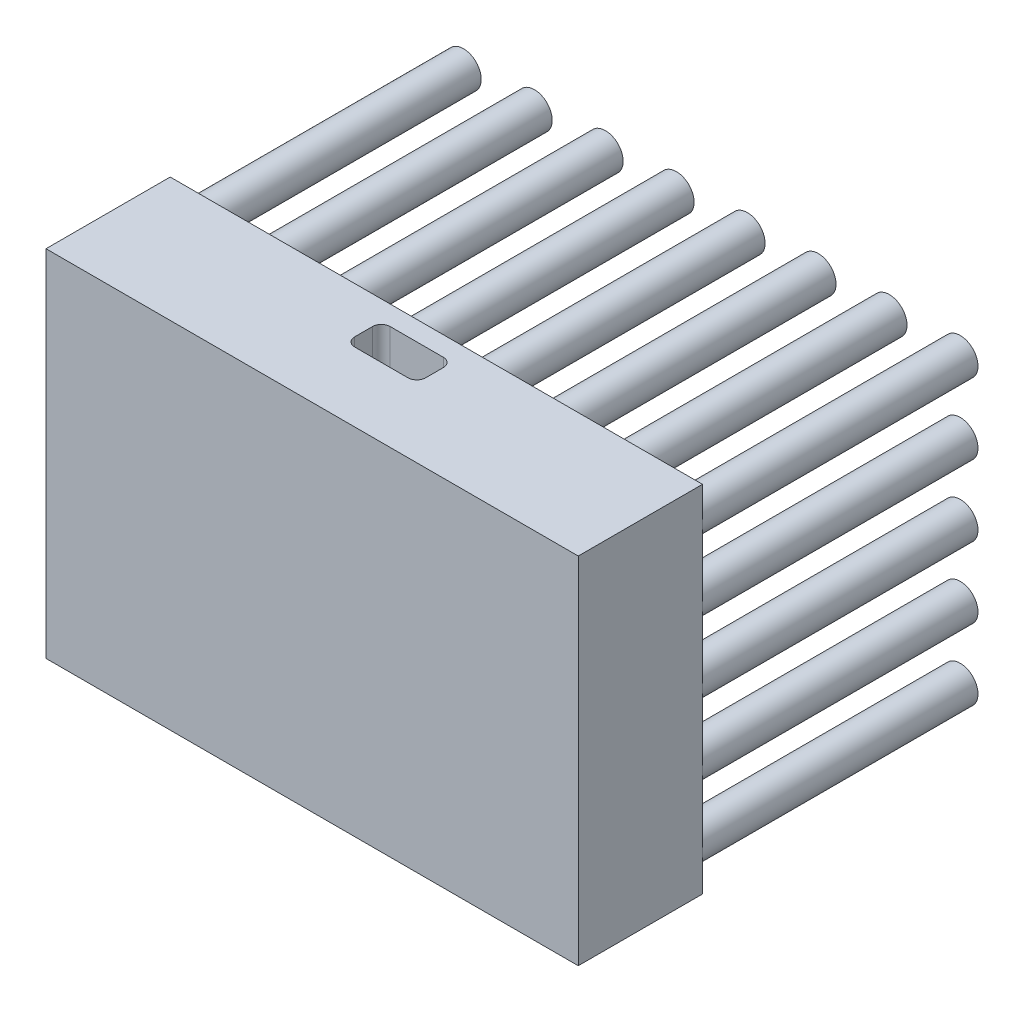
SolidWorks part; units mm, degrees
ref_plane "Спереди" through (0, 0, 0) normal (0, 0, 1) x (1, 0, 0)
ref_plane "Сверху" through (0, 0, 0) normal (0, 1, 0) x (1, 0, 0)
ref_plane "Справа" through (0, 0, 0) normal (1, 0, 0) x (0, 0, -1)
sketch "Эскиз1" plane through (0, 0, 0) normal (0, 0, 1) x (1, 0, 0)
  line L1 (0, 0) -> (-30, 0)
  line L2 (0, 0) -> (0, 20)
  line L3 (0, 20) -> (-30, 20)
  line L4 (-30, 0) -> (-30, 20)
  dimension "D1" = 20
  dimension "D2" = 30
extrude "Бобышка-Вытянуть1" add sketch "Эскиз1" along normal blind 7
sketch "Эскиз2" plane through (0, 0, 0) normal (0, 0, -1) x (-1, 0, 0)
  line L1 (0, 0) -> (0, 20) construction
  line L2 (0, 20) -> (30, 20) construction
  circle A0 centre (1, 2) radius 1
  circle A1 centre (5, 2) radius 1
  circle A2 centre (9, 2) radius 1
  circle A3 centre (13, 2) radius 1
  circle A4 centre (17, 2) radius 1
  circle A5 centre (21, 2) radius 1
  circle A6 centre (25, 2) radius 1
  circle A7 centre (29, 2) radius 1
  circle A8 centre (1, 6) radius 1
  circle A9 centre (1, 10) radius 1
  circle A10 centre (1, 14) radius 1
  circle A11 centre (1, 18) radius 1
  circle A12 centre (5, 18) radius 1
  circle A13 centre (5, 14) radius 1
  circle A14 centre (5, 10) radius 1
  circle A15 centre (5, 6) radius 1
  circle A16 centre (9, 18) radius 1
  circle A17 centre (9, 14) radius 1
  circle A18 centre (9, 10) radius 1
  circle A19 centre (9, 6) radius 1
  circle A20 centre (13, 18) radius 1
  circle A21 centre (13, 14) radius 1
  circle A22 centre (13, 10) radius 1
  circle A23 centre (13, 6) radius 1
  circle A24 centre (17, 18) radius 1
  circle A25 centre (17, 14) radius 1
  circle A26 centre (17, 10) radius 1
  circle A27 centre (17, 6) radius 1
  circle A28 centre (21, 18) radius 1
  circle A29 centre (21, 14) radius 1
  circle A30 centre (21, 10) radius 1
  circle A31 centre (21, 6) radius 1
  circle A32 centre (25, 18) radius 1
  circle A33 centre (25, 14) radius 1
  circle A34 centre (25, 10) radius 1
  circle A35 centre (25, 6) radius 1
  circle A36 centre (29, 18) radius 1
  circle A37 centre (29, 14) radius 1
  circle A38 centre (29, 10) radius 1
  circle A39 centre (29, 6) radius 1
  dimension "D1" = 2
  dimension "D3" = 1
  dimension "D5" = 2
  dimension "D2" = 8
  dimension "D4" = 5
  dimension "D6" = 8
extrude "Бобышка-Вытянуть2" add sketch "Эскиз2" along normal blind 15.53
sketch "Эскиз3" plane through (0, 0, 0) normal (0, -1, 0) x (-1, 0, 0)
  line L0 (30, 0) -> (0, 0) construction
  line L1 (13, -1.1) -> (17, -1.1)
  line L2 (13, -1.1) -> (13, -3.1)
  line L3 (13, -3.1) -> (17, -3.1)
  line L4 (17, -1.1) -> (17, -3.1)
  line L5 (0, -7) -> (0, 0) construction
  dimension "D1" = 4
  dimension "D2" = 2
  dimension "D3" = 1.1
  dimension "D4" = 13
extrude "Вырез-Вытянуть1" cut sketch "Эскиз3" against normal blind 20
fillet "Скругление1" radius 0.5 1 edges at (-13, 10, 1.1)
fillet "Скругление2" radius 0.5 3 edges at (-13, 10, 3.1) (-17, 10, 3.1) (-17, 10, 1.1)
